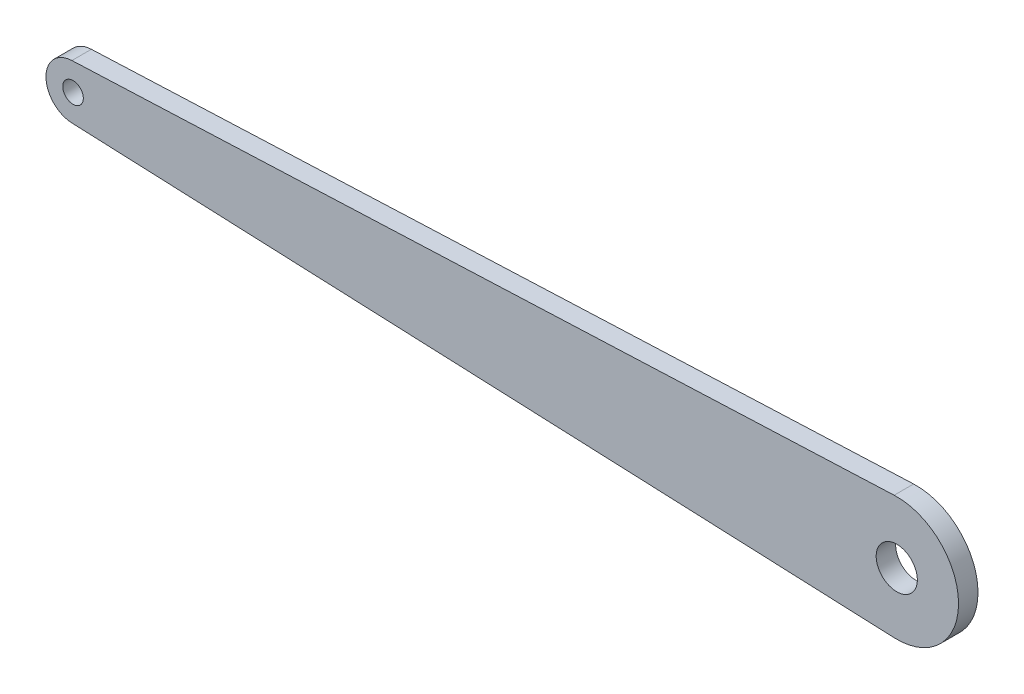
SolidWorks part; units mm, degrees
ref_plane "Front Plane" through (0, 0, 0) normal (0, 0, 1) x (1, 0, 0)
ref_plane "Top Plane" through (0, 0, 0) normal (0, 1, 0) x (1, 0, 0)
ref_plane "Right Plane" through (0, 0, 0) normal (1, 0, 0) x (0, 0, -1)
sketch "Sketch1" plane through (0, 0, 0) normal (0, 0, 1) x (1, 0, 0)
  line L5 (-0.1759, 4.1713) -> (126.5987, 9.5165)
  line L6 (-0.1759, -4.1713) -> (126.5988, -9.5165)
  circle A6 centre (0, 0) radius 1.5875
  circle A7 centre (127, 0) radius 3.175
  arc A8 (-0.1759, 4.1713) -> (-0.1759, -4.1713) centre (0, 0) ccw
  arc A9 (126.5987, 9.5165) -> (126.5988, -9.5165) centre (127, 0) cw
  arc A10 (4.1452, 0.4976) -> (-4.1452, -0.4976) centre (0, 0) ccw construction
  dimension "D3" = 127
  dimension "D5" = 9.525
  dimension "D1" = 3.175
  dimension "D2" = 6.35
extrude "Boss-Extrude1" add sketch "Sketch1" along normal blind 3
